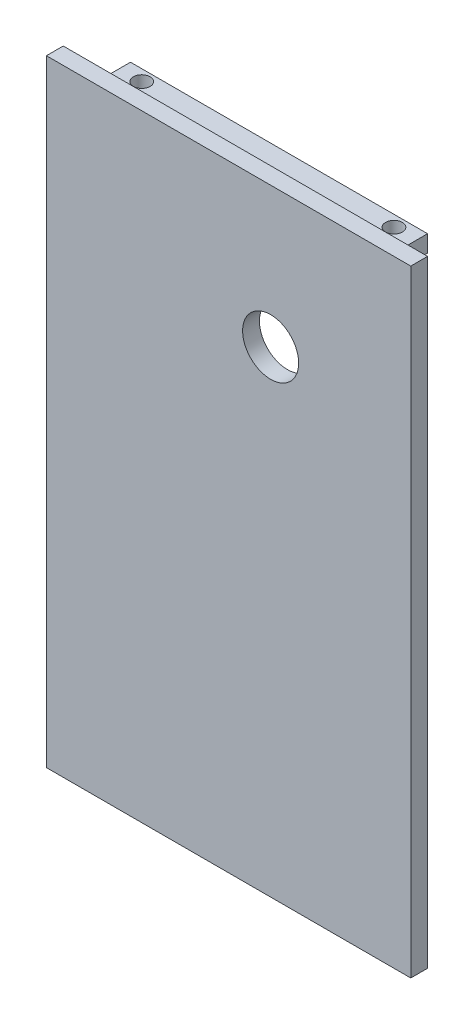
SolidWorks part; units mm, degrees
ref_plane "Front Plane" through (0, 0, 0) normal (0, 0, 1) x (1, 0, 0)
ref_plane "Top Plane" through (0, 0, 0) normal (0, 1, 0) x (1, 0, 0)
ref_plane "Right Plane" through (0, 0, 0) normal (1, 0, 0) x (0, 0, -1)
sketch "Sketch1" plane through (0, 0, 0) normal (0, 0, 1) x (1, 0, 0)
  line L1 (-32.5, 55) -> (32.5, 55)
  line L2 (-32.5, 55) -> (-32.5, -55)
  line L3 (-32.5, -55) -> (32.5, -55)
  line L4 (32.5, 55) -> (32.5, -55)
  line L5 (-32.5, 55) -> (32.5, -55) construction
  line L6 (-32.5, -55) -> (32.5, 55) construction
  point P0 (0, 0)
  dimension "D1" = 110
  dimension "D2" = 65
extrude "Boss-Extrude1" add sketch "Sketch1" along normal blind 3
sketch "Sketch3" plane through (-32.5, 0, 0) normal (-1, 0, 0) x (0, 0, 1)
  line L0 (3, -55) -> (0, -55)
  line L1 (0, -55) -> (0, -52.5)
  line L2 (0, 55) -> (3, 55)
  line L3 (3, 55) -> (3, -55)
  line L4 (0, -52.5) -> (-6, -52.5)
  line L5 (-6, -52.5) -> (-6, -49.5)
  line L6 (-6, -49.5) -> (0, -49.5)
  line L7 (0, 52.5) -> (-6, 52.5)
  line L8 (-6, 52.5) -> (-6, 49.5)
  line L9 (-6, 49.5) -> (0, 49.5)
  line L10 (0, -49.5) -> (0, 49.5)
  line L11 (0, 52.5) -> (0, 55)
  dimension "D1" = 2.5
  dimension "D2" = 2.5
  dimension "D3" = 6
  dimension "D4" = 3
extrude "Boss-Extrude2" add sketch "Sketch3" against normal through all
sketch "Sketch5" plane through (0, -52.5, 0) normal (0, -1, 0) x (-1, 0, 0)
  line L0 (56.4821, 0) -> (-56.4821, 0) construction
  line L1 (32.5, 6) -> (32.5, 0)
  line L2 (32.5, 0) -> (26.5, 0)
  line L3 (26.5, 0) -> (26.5, 6)
  line L4 (-32.5, 6) -> (32.5, 6) construction
  line L5 (26.5, 6) -> (32.5, 6)
  line L6 (-32.5, 0) -> (-32.5, 6)
  line L7 (-32.5, 6) -> (-26.5, 6)
  line L8 (-26.5, 6) -> (-26.5, 0)
  line L9 (-26.5, 0) -> (-32.5, 0)
  point P4 (0, 0)
  dimension "D1" = 6
  dimension "D2" = 6
extrude "Cut-Extrude1" cut sketch "Sketch5" against normal through all
sketch "Sketch7" plane through (0, 0, 3) normal (0, 0, 1) x (1, 0, 0)
  line L0 (32.5, -55) -> (32.5, 55) construction
  line L1 (32.5, 55) -> (-32.5, 55) construction
  circle A0 centre (7.5, 30) radius 5
  point P4 (0, 0)
  dimension "D1" = 10
  dimension "D2" = 25
  dimension "D3" = 25
extrude "Cut-Extrude3" cut sketch "Sketch7" against normal through all
sketch "Sketch8" plane through (0, 52.5, 0) normal (0, 1, 0) x (1, 0, 0)
  line L0 (-26.5, 0) -> (-26.5, 6) construction
  line L2 (26.5, 6) -> (-26.5, 6) construction
  line L3 (26.5, 6) -> (26.5, 0) construction
  circle A0 centre (-22.5, 4) radius 1.5
  circle A1 centre (22.5, 4) radius 1.5
  dimension "D1" = 4
  dimension "D2" = 4
  dimension "D4" = 2
  dimension "D5" = 3
  dimension "D6" = 3
  dimension "4" = 2
extrude "Cut-Extrude4" cut sketch "Sketch8" against normal through all
